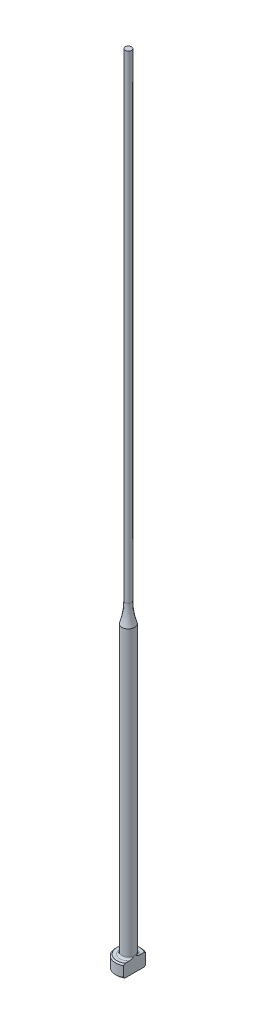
SolidWorks part; units mm, degrees
ref_plane "Front Plane" through (0, 0, 0) normal (0, 0, 1) x (1, 0, 0)
ref_plane "Top Plane" through (0, 0, 0) normal (0, 1, 0) x (1, 0, 0)
ref_plane "Right Plane" through (0, 0, 0) normal (1, 0, 0) x (0, 0, -1)
sketch "Sketch1" plane through (0, 0, 0) normal (0, 0, 1) x (1, 0, 0)
  line L0 (0, 259.9588) -> (0, -15.1925) construction
  line L1 (0, 0) -> (-2, 0)
  line L2 (-2, 0) -> (-2, 2)
  line L3 (-2, 2) -> (-1, 2)
  line L4 (-0.5, 50) -> (-0.5, 125)
  line L5 (-0.5, 125) -> (0, 125)
  line L6 (0, 125) -> (0, 0)
  line L7 (-1, 2) -> (-1, 46.8775)
  arc A0 (-1, 46.8775) -> (-0.5, 50) centre (-10.5, 50) ccw
  point P13 (-1, 0)
  dimension "D1" = 10
  dimension "L" = 125
  dimension "H" = 4
  dimension "T" = 2
  dimension "D" = 1
  dimension "B" = 2
  dimension "S" = 50
revolve "Revolve1" add sketch "Sketch1" angle 360 about L0
chamfer "Chamfer1" distance 0.2 angle 45 2 edges at (0, 2, 2) (0, 0, 2)
fillet "Fillet1" radius 0.3 1 edges at (0, 2, 1)
sketch "Sketch2" plane through (0, 0, 0) normal (0, 1, 0) x (1, 0, 0)
  line L0 (1, 1.7321) -> (1, -1.7321)
  circle A0 centre (0, 0) radius 2 construction
  arc A1 (1, -1.7321) -> (1, 1.7321) centre (0, 0) ccw
  circle A2 centre (0, 0) radius 1 construction
extrude "KEY" cut sketch "Sketch2" along normal through all
